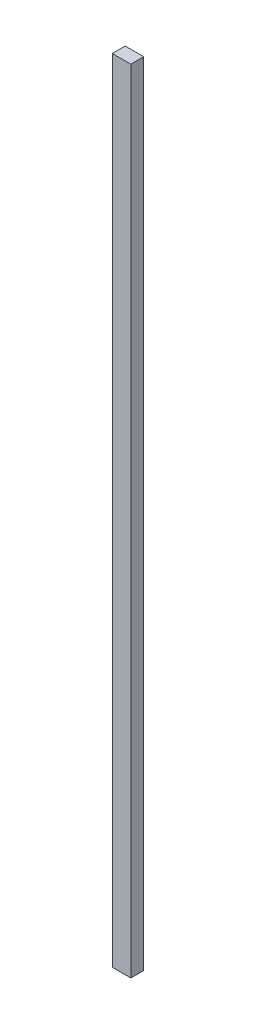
SolidWorks part; units mm, degrees
ref_plane "Front Plane" through (0, 0, 0) normal (0, 0, 1) x (1, 0, 0)
ref_plane "Top Plane" through (0, 0, 0) normal (0, 1, 0) x (1, 0, 0)
ref_plane "Right Plane" through (0, 0, 0) normal (1, 0, 0) x (0, 0, -1)
sketch "Sketch1" plane through (0, 0, 0) normal (0, 0, 1) x (1, 0, 0)
  line L1 (-10.6149, 182.6194) -> (-5.1539, 182.6194)
  line L2 (-10.6149, 182.6194) -> (-10.6149, -50.6796)
  line L3 (-10.6149, -50.6796) -> (-5.1539, -50.6796)
  line L4 (-5.1539, 182.6194) -> (-5.1539, -50.6796)
  dimension "D1" = 233.299
  dimension "D2" = 5.461
extrude "Extrude1" add sketch "Sketch1" along normal blind 3.81
